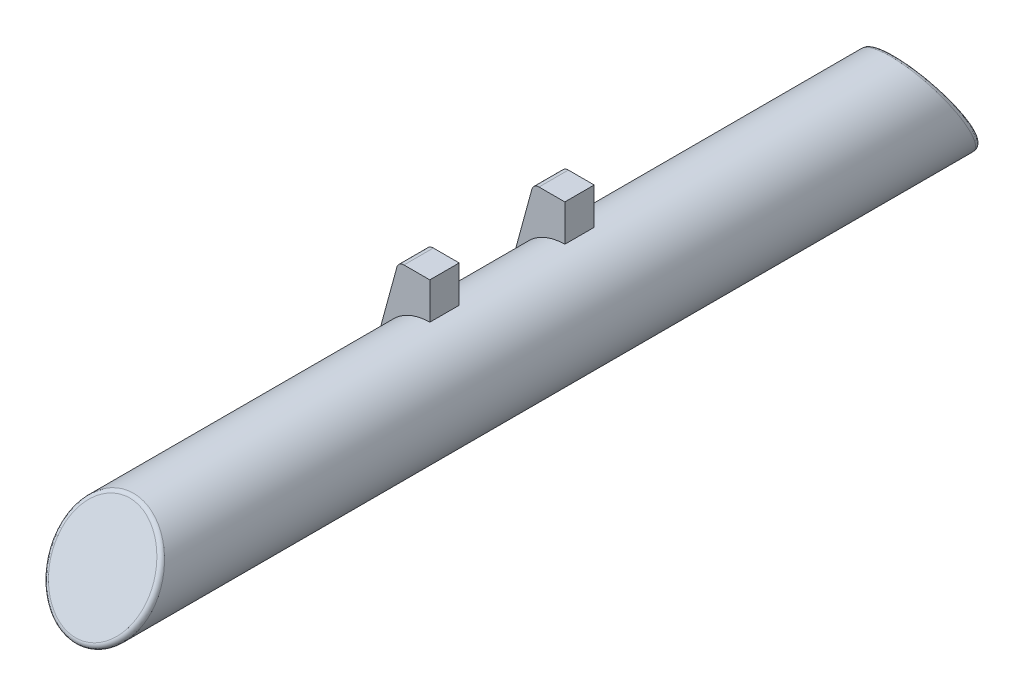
SolidWorks part; units mm, degrees
ref_plane "Plan de face" through (0, 0, 0) normal (0, 0, 1) x (1, 0, 0)
ref_plane "Plan de dessus" through (0, 0, 0) normal (0, 1, 0) x (1, 0, 0)
ref_plane "Plan de droite" through (0, 0, 0) normal (1, 0, 0) x (0, 0, -1)
sketch "Esquisse1" plane through (0, 0, 0) normal (0, 0, 1) x (1, 0, 0)
  circle A0 centre (0, 0) radius 3.5
  dimension "D1" = 7
extrude "Extrusion1" add sketch "Esquisse1" along normal blind 60
sketch "Esquisse2" plane through (0, 0, 0) normal (1, 0, 0) x (0, 0, -1)
  line L0 (0, -3.5) -> (-9.2828, 12.5783)
  line L1 (-9.2828, 12.5783) -> (0, 12.5783)
  line L2 (0, 12.5783) -> (0, -3.5)
  line L3 (-30, -3.5) -> (-30, 13.2021) construction
  line L4 (-60, -3.5) -> (0, -3.5) construction
  line L5 (-60, 12.5783) -> (-60, -3.5)
  line L6 (-50.7172, 12.5783) -> (-60, 12.5783)
  line L7 (-60, -3.5) -> (-50.7172, 12.5783)
  dimension "D1" = 30
extrude "Enlèv. mat.-Extru.1" cut sketch "Esquisse2" against normal mid plane 10
fillet "Congé1" radius 0.3 2 edges at (0, 3.5, 55.9585) (0, -3.5, 0)
ref_plane "Plan milieu" through (0, 0, 30) normal (0, 0, 1) x (1, 0, 0)
ref_plane "Plan1" through (0, 0, 33.6) normal (0, 0, 1) x (1, 0, 0)
sketch "Esquisse3" plane through (0, 0, 33.6) normal (0, 0, 1) x (1, 0, 0)
  line L0 (0, 0) -> (-3.7786, 0)
  line L1 (-3.7786, 0) -> (-2.1426, 6)
  line L2 (-2.1426, 6) -> (0, 6)
  line L3 (0, 6) -> (0, 0)
  dimension "D1" = 6
extrude "Extrusion2" add sketch "Esquisse3" along normal blind 2
fillet "Congé2" radius 0.5 2 edges at (-2.1426, 6, 34.6) (-3.7786, 0, 34.6)
ref_plane "Plan2" through (0, 0, 26.4) normal (0, 0, 1) x (1, 0, 0)
sketch "Esquisse4" plane through (0, 0, 26.4) normal (0, 0, 1) x (1, 0, 0)
  line L4 (-3.7786, 0) -> (0, 0)
  line L5 (-2.1426, 6) -> (-3.7786, 0)
  line L6 (0, 6) -> (-2.1426, 6)
  line L7 (0, 0) -> (0, 6)
  line L8 (-3.7786, 0) -> (0, 0)
  line L9 (-2.1426, 6) -> (-3.7786, 0)
  line L10 (0, 6) -> (-2.1426, 6)
  line L11 (0, 0) -> (0, 6)
  dimension "D1" = 0
extrude "Extrusion3" add sketch "Esquisse4" against normal blind 2
fillet "Congé3" radius 0.5 2 edges at (-3.7786, 0, 25.4) (-2.1426, 6, 25.4)
